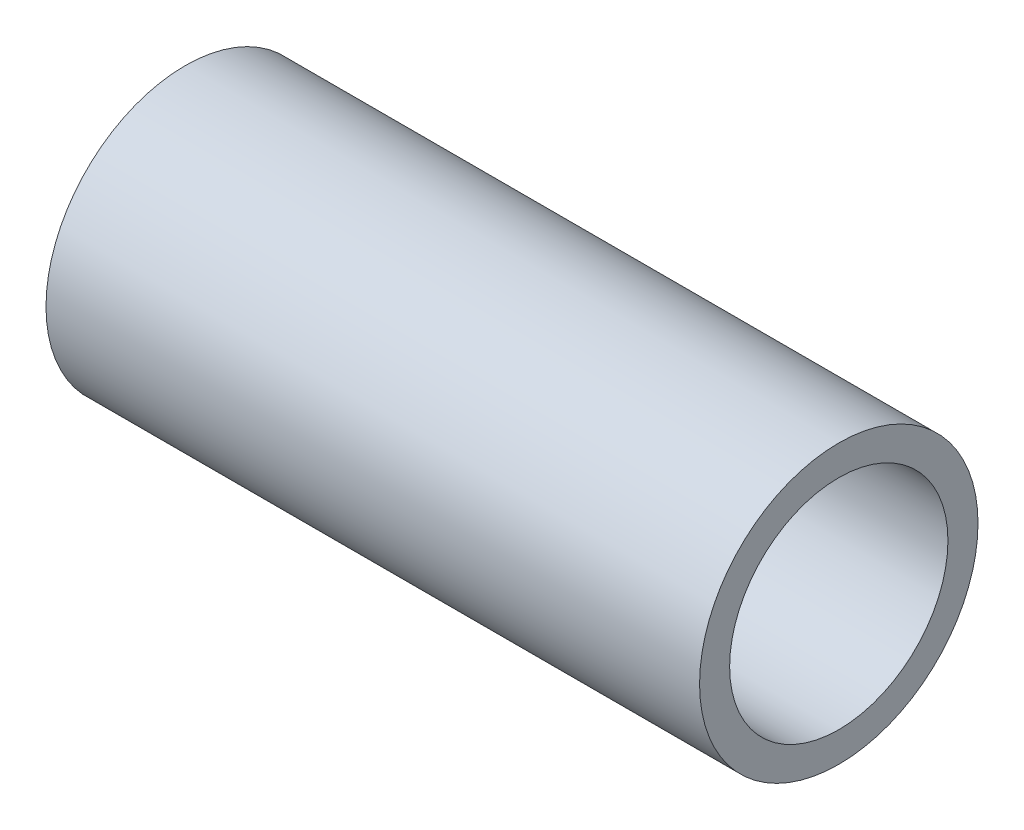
SolidWorks part; units mm, degrees
ref_plane "Plan de face" through (0, 0, 0) normal (0, 0, 1) x (1, 0, 0)
ref_plane "Plan de dessus" through (0, 0, 0) normal (0, 1, 0) x (1, 0, 0)
ref_plane "Plan de droite" through (0, 0, 0) normal (1, 0, 0) x (0, 0, -1)
sketch "Esquisse1" plane through (0, 0, 0) normal (0, 0, 1) x (1, 0, 0)
  line L0 (0, 0) -> (50, 0)
  dimension "D1" = 50
ref_plane "Plan1" through (0, 0, 0) normal (1, 0, 0) x (0, 0, -1)
sketch "Esquisse2" plane through (0, 0, 0) normal (1, 0, 0) x (0, 0, -1)
  circle A0 centre (0, 0) radius 10.65
  circle A1 centre (0, 0) radius 8.35
  dimension "D1" = 21.3
  dimension "D2" = 2.3
sweep "Balayage1" add profiles "Esquisse2" path "Esquisse1"
